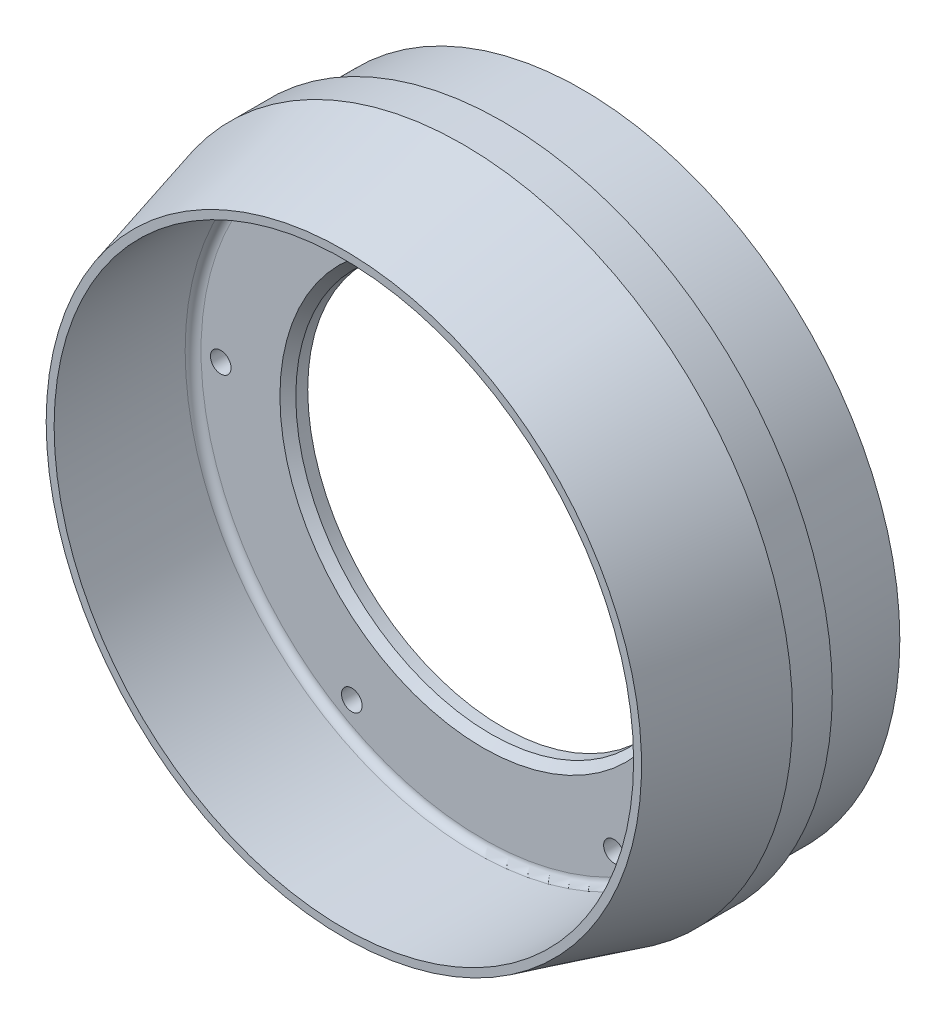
SolidWorks part; units mm, degrees
ref_plane "Front Plane" through (0, 0, 0) normal (0, 0, 1) x (1, 0, 0)
ref_plane "Top Plane" through (0, 0, 0) normal (0, 1, 0) x (1, 0, 0)
ref_plane "Right Plane" through (0, 0, 0) normal (1, 0, 0) x (0, 0, -1)
sketch "Sketch2" plane through (0, 0, 0) normal (1, 0, 0) x (0, 0, -1)
  line L0 (-5, 83) -> (-35, 74.9615)
  line L1 (-35, 74.9615) -> (-35, 72.9615)
  line L2 (-35, 72.9615) -> (0, 72.9615)
  line L3 (0, 72.9615) -> (0, 49.1)
  line L5 (-5, 83) -> (5, 83)
  line L6 (0, 0) -> (0, 120.0745) construction
  line L8 (5, 77.5) -> (25, 77.5)
  line L9 (25, 77.5) -> (25, 80)
  line L10 (5, 80) -> (5, 83)
  line L11 (25, 80) -> (5, 80)
  line L12 (0, 49.1) -> (5, 49.1)
  line L14 (5, 49.1) -> (5, 77.5)
  point P1 (0, 0)
  point P7 (0, 0)
  point P9 (0, 0)
  point P16 (0, 83)
  dimension "D1" = 5
  dimension "D2" = 2.5
  dimension "D3" = 10
  dimension "D4" = 3
  dimension "D5" = 49.1
  dimension "D6" = 35
  dimension "D7" = 2
  dimension "D8" = 15
  dimension "D9" = 80
  dimension "D10" = 20
ref_axis "Axis1" through (0, 0, -77) along (0, 0, 1)
revolve "Revolve1" add sketch "Sketch2" angle 360 about axis through (0, 0, -77) along (0, 0, 1)
chamfer "Chamfer1" distance 2 angle 45 1 edges at (-77.5, 0, -25)
chamfer "Chamfer2" distance 2 angle 45 1 edges at (-49.1, 0, 0)
hole_wizard "#6 (0.204) Diameter Hole1" positions "Sketch4" profile "Sketch5" hole size "#6" standard "ANSI Inch"
sketch "Sketch4" plane through (0, 0, 0) normal (0, 0, 1) x (1, 0, 0)
  line L0 (0, 0) -> (0, 39.3331) construction
  line L2 (0, 0) -> (-33, 57.1577) construction
  circle A0 centre (0, 0) radius 66
  point P5 (-33, 57.1577)
  dimension "D2" = 132
  dimension "D1" = 30
sketch "Sketch5" plane through (-33, 57.1577, 0) normal (1, 0, 0) x (0, -1, 0)
  line L0 (0, 0) -> (0, 6.5557)
  line L1 (0, 6.5557) -> (2.5908, 4.999)
  line L2 (2.5908, 4.999) -> (2.5908, 0)
  line L5 (2.5908, 0) -> (0, 0)
  line L10 (0, 6.5557) -> (-2.5908, 4.999) construction
  line L11 (0, -6.35) -> (0, 107.95) construction
  dimension "Hole Dia." = 5.1816
  dimension "Hole Depth" = 4.999
  dimension "Drill Angle" = 118
pattern_circular "CirPattern1" count 6 over 360 about axis through (0, 0, 0) along (0, 0, 1) of "#6 (0.204) Diameter Hole1"
fillet "Fillet2" radius 5 1 edges at (-77.5, 0, -5)
fillet "Fillet3" radius 2 1 edges at (-72.9615, 0, 0)
